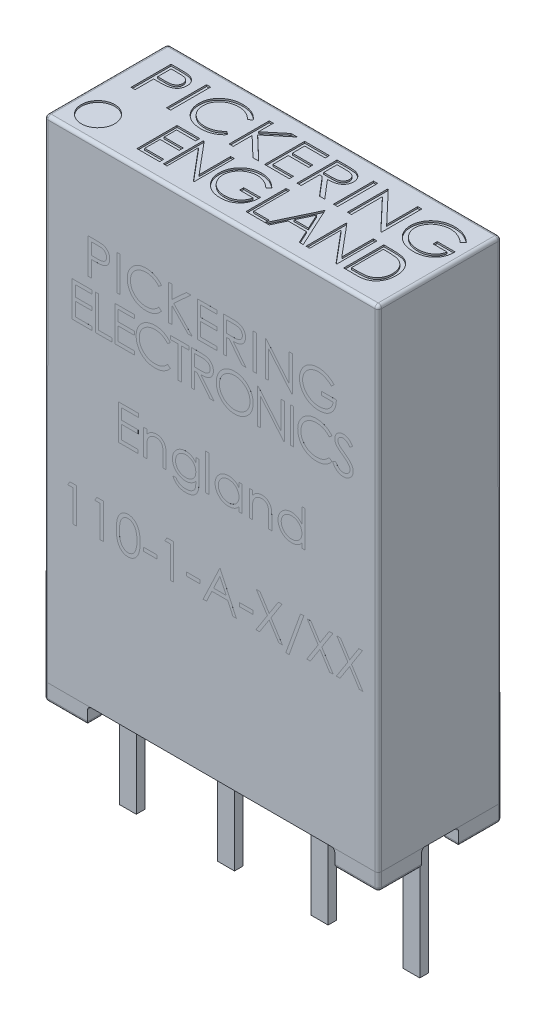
SolidWorks part; units mm, degrees
ref_plane "Front Plane" through (0, 0, 0) normal (0, 0, 1) x (1, 0, 0)
ref_plane "Top Plane" through (0, 0, 0) normal (0, 1, 0) x (1, 0, 0)
ref_plane "Right Plane" through (0, 0, 0) normal (1, 0, 0) x (0, 0, -1)
sketch "Sketch1" plane through (0, 0, 0) normal (0, 1, 0) x (1, 0, 0)
  line L1 (5, -1.85) -> (-5, -1.85)
  line L2 (5, -1.85) -> (5, 1.85)
  line L3 (5, 1.85) -> (-5, 1.85)
  line L4 (-5, -1.85) -> (-5, 1.85)
  line L5 (5, -1.85) -> (-5, 1.85) construction
  line L6 (5, 1.85) -> (-5, -1.85) construction
  point P0 (0, 0)
  dimension "D1" = 3.7
  dimension "D2" = 10
extrude "Main Body" add sketch "Sketch1" along normal blind 14.692 draft 0.02
sketch "Sketch2" plane through (0, 0, 0) normal (0, -1, 0) x (1, 0, 0)
  line L1 (-5, 1.85) -> (-3.7, 1.85)
  line L2 (-5, 1.85) -> (-5, 0.55)
  line L3 (-5, 0.55) -> (-4.5, 0.55)
  line L4 (-3.7, 1.85) -> (-3.7, 1.35)
  line L7 (-3.7, 1.35) -> (-4.5, 1.35)
  line L8 (-4.5, 0.55) -> (-4.5, 1.35)
  dimension "D1" = 1.3
  dimension "D2" = 1.3
  dimension "D3" = 0.5
  dimension "D4" = 0.5
extrude "Original foot" add sketch "Sketch2" along normal blind 0.508
mirror "Left Foot" about plane through (0, 0, 0) normal (0, 0, 1) of "Original foot"
mirror "Right Feet" about plane through (0, 0, 0) normal (1, 0, 0) of "Left Foot", "Original foot"
sketch "Sketch3" plane through (0, 0, 0) normal (0, -1, 0) x (1, 0, 0)
  line L1 (-4.4748, -0.127) -> (-3.9668, -0.127)
  line L2 (-4.4748, -0.127) -> (-4.4748, 0.127)
  line L3 (-4.4748, 0.127) -> (-3.9668, 0.127)
  line L4 (-3.9668, -0.127) -> (-3.9668, 0.127)
  line L5 (-4.4748, -0.127) -> (-3.9668, 0.127) construction
  line L6 (-4.4748, 0.127) -> (-3.9668, -0.127) construction
  line L7 (-1.0262, -0.127) -> (-1.5342, -0.127)
  line L8 (-1.0262, -0.127) -> (-1.0262, 0.127)
  line L9 (-1.0262, 0.127) -> (-1.5342, 0.127)
  line L10 (-1.5342, -0.127) -> (-1.5342, 0.127)
  line L11 (-1.0262, -0.127) -> (-1.5342, 0.127) construction
  line L12 (-1.0262, 0.127) -> (-1.5342, -0.127) construction
  line L13 (1.778, -0.127) -> (1.27, -0.127)
  line L14 (1.778, -0.127) -> (1.778, 0.127)
  line L15 (1.778, 0.127) -> (1.27, 0.127)
  line L16 (1.27, -0.127) -> (1.27, 0.127)
  line L17 (1.778, -0.127) -> (1.27, 0.127) construction
  line L18 (1.778, 0.127) -> (1.27, -0.127) construction
  line L19 (4.5225, -0.127) -> (4.0145, -0.127)
  line L20 (4.5225, -0.127) -> (4.5225, 0.127)
  line L21 (4.5225, 0.127) -> (4.0145, 0.127)
  line L22 (4.0145, -0.127) -> (4.0145, 0.127)
  line L23 (4.5225, -0.127) -> (4.0145, 0.127) construction
  line L24 (4.5225, 0.127) -> (4.0145, -0.127) construction
  point P0 (-4.2208, 0)
  point P5 (-1.2802, 0)
  point P10 (1.524, 0)
  point P15 (4.2685, 0)
  dimension "D1" = 0.508
  dimension "D2" = 0.254
  dimension "D3" = 0.508
  dimension "D4" = 0.254
  dimension "D5" = 0.508
  dimension "D6" = 0.254
  dimension "D7" = 0.508
  dimension "D8" = 0.254
extrude "Pins" add sketch "Sketch3" along normal blind 3.808
sketch "Sketch4"
  dimension "D6" = 1
  dimension "D1" = 9.1
  dimension "D2" = 0.445
  dimension "D3" = 7.5
  dimension "D4" = 1.7
  dimension "D5" = 1.5
  dimension "D7" = 0.8
  dimension "D8" = 0.8
extrude "Top Lettering" cut sketch "Sketch4" against normal blind 0.05
sketch "Sketch5"
  dimension "D1" = 8.6
  dimension "D2" = 0.6965
  dimension "D3" = 3.55
  dimension "D4" = 1.35
  dimension "D5" = 2.5
  dimension "D6" = 2.8
  dimension "D7" = 9
  dimension "D8" = 0.5
extrude "Lettering" add sketch "Sketch5" along normal blind 0.0001
fillet "Fillet1" radius 0.1 64 edges at (-3.7, 0, -1.6) (-4.75, 0, -0.55) (3.7, 0, -1.6) (4.75, 0, -0.55) (4.75, 0, 0.55) (3.7, 0, 1.6) (5, -0.254, -1.85) (5, -0.254, 1.85) (-5, -0.254, -1.85) (-5, -0.254, 1.85) (-3.7, -0.254, -1.35) (-4.1, 0, -1.35) (-4.5, -0.254, -1.35) (-4.5, -0.254, -0.55) (-4.5, 0, -0.95) (-3.7, -0.254, 1.35) (-4.1, 0, 1.35) (-4.5, -0.254, 0.55) (-4.5, -0.254, 1.35) (-4.5, 0, 0.95) (3.7, -0.254, -1.35) (4.1, 0, -1.35) (4.5, -0.254, -0.55) (4.5, -0.254, -1.35) (4.5, 0, -0.95) (4.5, -0.254, 0.55) (4.5, 0, 0.95) (3.7, -0.254, 1.35) (4.5, -0.254, 1.35) (4.1, 0, 1.35) (4.75, -0.508, 0.55) (4.5, -0.508, 0.95) (4.1, -0.508, 1.35) (3.7, -0.508, 1.6) (4.35, -0.508, 1.85) (5, -0.508, 1.2) (4.35, -0.508, -1.85) (3.7, -0.508, -1.6) (4.1, -0.508, -1.35) (4.5, -0.508, -0.95) (4.75, -0.508, -0.55) (5, -0.508, -1.2) (-4.35, -0.508, 1.85) (-3.7, -0.508, 1.6) (-4.1, -0.508, 1.35) (-4.5, -0.508, 0.95) (-4.75, -0.508, 0.55) (-5, -0.508, 1.2) (-4.75, -0.508, -0.55) (-4.5, -0.508, -0.95) (-4.1, -0.508, -1.35) (-3.7, -0.508, -1.6) (-4.35, -0.508, -1.85) (-5, -0.508, -1.2) (4.9974, 7.346, -1.8474) (4.9974, 7.346, 1.8474) (4.9949, 14.692, 0) (0, 14.692, 1.8449) (0, 14.692, -1.8449) (-4.9974, 7.346, -1.8474) (-4.9949, 14.692, 0) (-4.9974, 7.346, 1.8474)
